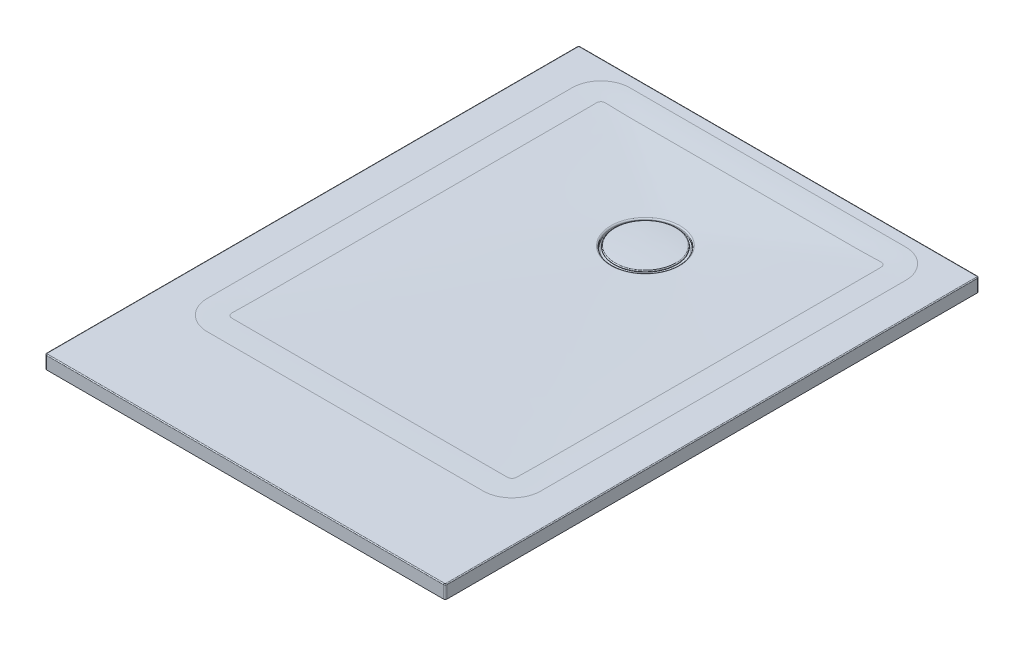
SolidWorks part; units mm, degrees
ref_plane "Płaszczyzna przednia" through (0, 0, 0) normal (0, 0, 1) x (1, 0, 0)
ref_plane "Płaszczyzna górna" through (0, 0, 0) normal (0, 1, 0) x (1, 0, 0)
ref_plane "Płaszczyzna prawa" through (0, 0, 0) normal (1, 0, 0) x (0, 0, -1)
sketch "Szkic2" plane through (0, 0, 0) normal (0, 1, 0) x (1, 0, 0)
  line L0 (0, 600) -> (0, 300) construction
  line L1 (-450, -600) -> (450, -600)
  line L2 (-450, -600) -> (-450, 600)
  line L3 (-450, 600) -> (450, 600)
  line L4 (450, -600) -> (450, 600)
  line L5 (-450, -600) -> (450, 600) construction
  line L6 (-450, 600) -> (450, -600) construction
  line L7 (-360, 560) -> (360, 560)
  line L8 (-360, 560) -> (-360, -360)
  line L9 (-360, -360) -> (360, -360)
  line L10 (360, 560) -> (360, -360)
  line L11 (-400, 600) -> (-400, -400) construction
  line L12 (-400, -400) -> (400, -400) construction
  line L13 (400, -400) -> (400, 600) construction
  circle A0 centre (0, 300) radius 75
  point P0 (0, 0)
  point P11 (0, 560)
  point P16 (0, -400)
  dimension "D9" = 150
  dimension "D1" = 900
  dimension "D2" = 1200
  dimension "D3" = 40
  dimension "D4" = 90
  dimension "D5" = 40
  dimension "D6" = 50
  dimension "D7" = 1000
  dimension "D8" = 300
  dimension "D10" = 800
sketch "Szkic3" plane through (0, 0, 0) normal (0, 1, 0) x (1, 0, 0)
  line L0 (-450, -600) -> (-450, 600) construction
  line L1 (-450, -600) -> (450, -600) construction
  line L2 (450, -600) -> (450, 600) construction
  line L3 (-450, 600) -> (450, 600) construction
  line L4 (-360, 560) -> (-360, -360) construction
  line L5 (-360, 560) -> (360, 560) construction
  line L6 (360, 560) -> (360, -360) construction
  line L7 (-360, -360) -> (360, -360) construction
  line L8 (-450, -600) -> (-450, 600)
  line L9 (-450, -600) -> (450, -600)
  line L10 (450, -600) -> (450, 600)
  line L11 (-450, 600) -> (450, 600)
  line L12 (-360, 510) -> (-360, -310)
  line L13 (-310, 560) -> (310, 560)
  line L14 (360, 510) -> (360, -310)
  line L15 (-310, -360) -> (310, -360)
  arc A0 (360, 510) -> (310, 560) centre (310, 510) ccw
  arc A1 (-310, 560) -> (-360, 510) centre (-310, 510) ccw
  arc A2 (310, -360) -> (360, -310) centre (310, -310) ccw
  arc A3 (-310, -360) -> (-360, -310) centre (-310, -310) cw
  dimension "D1" = 50
surface "Powierzchnia-Płaszczyzna1" sketch "Szkic3"
sketch "Szkic4" plane through (0, 0, 0) normal (0, 1, 0) x (1, 0, 0)
  line L0 (-360, 560) -> (-360, -360) construction
  line L1 (-360, -360) -> (360, -360) construction
  line L2 (360, 560) -> (360, -360) construction
  line L3 (-360, 560) -> (360, 560) construction
  line L4 (-360, 560) -> (-360, -360)
  line L5 (-360, -360) -> (360, -360)
  line L6 (360, 560) -> (360, -360)
  line L7 (-360, 560) -> (360, 560)
ref_plane "korek" through (0, -15, 0) normal (0, 1, 0) x (-1, 0, 0)
sketch "Szkic5" plane through (0, -15, 0) normal (0, 1, 0) x (-1, 0, 0)
  circle A0 centre (0, -300) radius 75 construction
  circle A1 centre (0, -300) radius 75
surface "Powierzchnia-Wyciągnięcie po profilach2"
surface "Powierzchnia-Połącz1"
sketch "Szkic7" plane through (0, 0, 0) normal (0, 1, 0) x (1, 0, 0)
  line L27 (310, 520) -> (-310, 520)
  line L28 (-320, 510) -> (-320, -310)
  line L29 (-310, -320) -> (310, -320)
  line L30 (320, -310) -> (320, 510)
  line L31 (310, 520) -> (-310, 520)
  line L32 (-320, 510) -> (-320, -310)
  line L33 (-310, -320) -> (310, -320)
  line L34 (320, -310) -> (320, 510)
  line L35 (310, 575) -> (-310, 575)
  line L36 (-375, 510) -> (-375, -310)
  line L37 (-310, -375) -> (310, -375)
  line L38 (375, -310) -> (375, 510)
  line L39 (310, 575) -> (-310, 575)
  line L40 (-375, 510) -> (-375, -310)
  line L41 (-310, -375) -> (310, -375)
  line L42 (375, -310) -> (375, 510)
  arc A0 (320, -310) -> (310, -320) centre (310, -310) cw
  arc A1 (-320, -310) -> (-310, -320) centre (-310, -310) ccw
  arc A2 (320, 510) -> (310, 520) centre (310, 510) ccw
  arc A3 (-320, 510) -> (-310, 520) centre (-310, 510) cw
  spline S23 degree 3 poles (-644.5147, 245.9802) (171.2043, 418.8752) (326.2977, 479.1809) (319.7452, 512.2677) (319.6663, 512.5844) (319.4754, 513.2122) (319.3641, 513.5243) (318.9882, 514.4323) (318.6812, 515.0063) (318.1376, 515.8212) (317.9416, 516.0859) (317.5238, 516.5955) (317.304, 516.838) (316.6127, 517.5298) (316.1098, 517.9439) (315.2907, 518.4921) (315.0069, 518.6625) (314.4301, 518.9711) (314.1356, 519.1106) (313.5345, 519.3602) (313.2279, 519.4703) (312.6025, 519.661) (312.2823, 519.7414) (192.0567, 543.8686) (-178.4054, -1686.1953) (51.6297, 1486.0367) knots -6.287354 -6.287354 -6.287354 -6.287354 0.125 0.125 0.1875 0.1875 0.25 0.25 0.375 0.375 0.4375 0.4375 0.5 0.5 0.625 0.625 0.6875 0.6875 0.75 0.75 0.8125 0.8125 0.875 0.875 24.080329 24.080329 24.080329 24.080329 only from (320, 510) to (310, 520)
  spline S24 degree 3 poles (-25.2636, -438.6041) (-190.5008, 290.0705) (-272.1359, 527.7513) (-312.2676, 519.7447) (-312.5843, 519.666) (-313.2122, 519.4757) (-313.5243, 519.3641) (-314.4322, 518.9881) (-315.0062, 518.6811) (-315.8213, 518.1376) (-316.086, 517.9416) (-316.5956, 517.5238) (-316.838, 517.304) (-317.5298, 516.6127) (-317.9438, 516.1098) (-318.4921, 515.2908) (-318.6622, 515.0069) (-318.9712, 514.4302) (-319.1106, 514.1357) (-319.3602, 513.5345) (-319.4701, 513.2278) (-319.6613, 512.6026) (-319.7419, 512.2823) (-327.5146, 473.272) (-107.0082, 409.1952) (654.3408, 284.9484) knots -7.667846 -7.667846 -7.667846 -7.667846 0.125 0.125 0.1875 0.1875 0.25 0.25 0.375 0.375 0.4375 0.4375 0.5 0.5 0.625 0.625 0.6875 0.6875 0.75 0.75 0.8125 0.8125 0.875 0.875 8.361168 8.361168 8.361168 8.361168 only from (-310, 520) to (-320, 510)
  spline S25 degree 3 poles (644.5148, -45.9802) (-171.2043, -218.8752) (-326.2977, -279.1809) (-319.7452, -312.2677) (-319.6663, -312.5844) (-319.4754, -313.2122) (-319.3641, -313.5243) (-318.9882, -314.4323) (-318.6812, -315.0063) (-318.1376, -315.8212) (-317.9416, -316.0859) (-317.5238, -316.5955) (-317.304, -316.838) (-316.6127, -317.5298) (-316.1098, -317.9439) (-315.2907, -318.4921) (-315.0069, -318.6625) (-314.4301, -318.9711) (-314.1356, -319.1106) (-313.5345, -319.3602) (-313.2279, -319.4703) (-312.6025, -319.661) (-312.2823, -319.7414) (-192.0567, -343.8686) (178.4054, 1886.1953) (-51.6297, -1286.0366) knots -6.287354 -6.287354 -6.287354 -6.287354 0.125 0.125 0.1875 0.1875 0.25 0.25 0.375 0.375 0.4375 0.4375 0.5 0.5 0.625 0.625 0.6875 0.6875 0.75 0.75 0.8125 0.8125 0.875 0.875 24.080329 24.080329 24.080329 24.080329 only from (-320, -310) to (-310, -320)
  spline S26 degree 3 poles (25.2636, 638.6045) (190.5008, -90.0705) (272.1359, -327.7513) (312.2676, -319.7447) (312.5843, -319.666) (313.2122, -319.4757) (313.5243, -319.3641) (314.4322, -318.9881) (315.0062, -318.6811) (315.8213, -318.1376) (316.086, -317.9416) (316.5956, -317.5238) (316.838, -317.304) (317.5298, -316.6127) (317.9438, -316.1098) (318.4921, -315.2908) (318.6622, -315.0069) (318.9712, -314.4302) (319.1106, -314.1357) (319.3602, -313.5345) (319.4701, -313.2278) (319.6613, -312.6026) (319.7419, -312.2823) (327.5146, -273.272) (107.0082, -209.1952) (-654.3408, -84.9484) knots -7.667846 -7.667846 -7.667846 -7.667846 0.125 0.125 0.1875 0.1875 0.25 0.25 0.375 0.375 0.4375 0.4375 0.5 0.5 0.625 0.625 0.6875 0.6875 0.75 0.75 0.8125 0.8125 0.875 0.875 8.361168 8.361168 8.361168 8.361168 only from (310, -320) to (320, -310)
  spline S31 degree 3 poles (-2411.2497, -561.1168) (-504.134, -35.3091) (394.2974, 318.7123) (374.4765, 518.4945) (374.1667, 520.5876) (373.3425, 524.739) (372.8287, 526.7974) (371.9013, 529.8583) (371.5655, 530.8759) (370.8439, 532.8945) (370.4596, 533.8908) (368.4228, 538.8084) (366.4283, 542.5401) (363.4836, 546.9545) (362.8718, 547.8248) (361.6019, 549.5396) (360.942, 550.3863) (358.9052, 552.8704) (357.4762, 554.4467) (352.9826, 558.9434) (349.7136, 561.6342) (345.2773, 564.6045) (344.3698, 565.1802) (342.5353, 566.2814) (341.6079, 566.8073) (338.7958, 568.3123) (336.8813, 569.2189) (332.9739, 570.8414) (330.9811, 571.5573) (327.9323, 572.4866) (326.9061, 572.7721) (324.8334, 573.2938) (323.785, 573.5303) (320.6361, 574.1599) (318.5251, 574.4738) (160.3036, 590.1164) (-57.9127, 46.5648) (-477.109, -2305.5721) knots -5.792026 -5.792026 -5.792026 -5.792026 0.0625 0.0625 0.125 0.125 0.1875 0.1875 0.21875 0.21875 0.25 0.25 0.375 0.375 0.40625 0.40625 0.4375 0.4375 0.5 0.5 0.625 0.625 0.65625 0.65625 0.6875 0.6875 0.75 0.75 0.8125 0.8125 0.84375 0.84375 0.875 0.875 0.9375 0.9375 5.533899 5.533899 5.533899 5.533899 only from (375, 510) to (310, 575)
  spline S32 degree 3 poles (602.1157, -2270.1847) (46.7654, 141.1642) (-174.116, 588.7103) (-318.4946, 574.4774) (-320.5876, 574.1671) (-324.7389, 573.342) (-326.7973, 572.8284) (-329.8583, 571.9014) (-330.8759, 571.5658) (-332.8944, 570.844) (-333.8907, 570.4597) (-338.8083, 568.4228) (-342.5401, 566.4283) (-346.9545, 563.4836) (-347.8247, 562.8718) (-349.5395, 561.6019) (-350.3863, 560.9421) (-352.8704, 558.9052) (-354.4467, 557.4762) (-358.9434, 552.9826) (-361.6341, 549.7136) (-364.6044, 545.2774) (-365.1802, 544.37) (-366.2813, 542.5354) (-366.8072, 541.608) (-368.3123, 538.7959) (-369.2189, 536.8814) (-370.8413, 532.974) (-371.5571, 530.981) (-372.4867, 527.9324) (-372.7723, 526.9062) (-373.294, 524.8335) (-373.5306, 523.7851) (-374.1595, 520.6361) (-374.4729, 518.525) (-416.7647, 93.4814) (3767.3883, -798.9712) (-1250.761, -669.055) knots -4.150679 -4.150679 -4.150679 -4.150679 0.0625 0.0625 0.125 0.125 0.1875 0.1875 0.21875 0.21875 0.25 0.25 0.375 0.375 0.40625 0.40625 0.4375 0.4375 0.5 0.5 0.625 0.625 0.65625 0.65625 0.6875 0.6875 0.75 0.75 0.8125 0.8125 0.84375 0.84375 0.875 0.875 0.9375 0.9375 13.39139 13.39139 13.39139 13.39139 only from (-310, 575) to (-375, 510)
  spline S33 degree 3 poles (2411.2502, 761.1169) (504.134, 235.3091) (-394.2974, -118.7123) (-374.4765, -318.4945) (-374.1667, -320.5876) (-373.3425, -324.739) (-372.8287, -326.7974) (-371.9013, -329.8583) (-371.5655, -330.8759) (-370.8439, -332.8945) (-370.4596, -333.8908) (-368.4228, -338.8084) (-366.4283, -342.5401) (-363.4836, -346.9545) (-362.8718, -347.8248) (-361.6019, -349.5396) (-360.942, -350.3863) (-358.9052, -352.8704) (-357.4762, -354.4467) (-352.9826, -358.9434) (-349.7136, -361.6342) (-345.2773, -364.6045) (-344.3698, -365.1802) (-342.5353, -366.2814) (-341.6079, -366.8073) (-338.7958, -368.3123) (-336.8813, -369.2189) (-332.9739, -370.8414) (-330.9811, -371.5573) (-327.9323, -372.4866) (-326.9061, -372.7721) (-324.8334, -373.2938) (-323.785, -373.5303) (-320.6361, -374.1599) (-318.5251, -374.4738) (-160.3036, -390.1164) (57.9127, 153.4352) (477.109, 2505.5721) knots -5.792026 -5.792026 -5.792026 -5.792026 0.0625 0.0625 0.125 0.125 0.1875 0.1875 0.21875 0.21875 0.25 0.25 0.375 0.375 0.40625 0.40625 0.4375 0.4375 0.5 0.5 0.625 0.625 0.65625 0.65625 0.6875 0.6875 0.75 0.75 0.8125 0.8125 0.84375 0.84375 0.875 0.875 0.9375 0.9375 5.533899 5.533899 5.533899 5.533899 only from (-375, -310) to (-310, -375)
  spline S34 degree 3 poles (-602.1157, 2470.1846) (-46.7654, 58.8358) (174.116, -388.7103) (318.4946, -374.4774) (320.5876, -374.1671) (324.7389, -373.342) (326.7973, -372.8284) (329.8583, -371.9014) (330.8759, -371.5658) (332.8944, -370.844) (333.8907, -370.4597) (338.8083, -368.4228) (342.5401, -366.4283) (346.9545, -363.4836) (347.8247, -362.8718) (349.5395, -361.6019) (350.3863, -360.9421) (352.8704, -358.9052) (354.4467, -357.4762) (358.9434, -352.9826) (361.6341, -349.7136) (364.6044, -345.2774) (365.1802, -344.37) (366.2813, -342.5354) (366.8072, -341.608) (368.3123, -338.7959) (369.2189, -336.8814) (370.8413, -332.974) (371.5571, -330.981) (372.4867, -327.9324) (372.7723, -326.9062) (373.294, -324.8335) (373.5306, -323.7851) (374.1595, -320.6361) (374.4729, -318.525) (416.7647, 106.5186) (-3767.3883, 998.9712) (1250.7611, 869.055) knots -4.150679 -4.150679 -4.150679 -4.150679 0.0625 0.0625 0.125 0.125 0.1875 0.1875 0.21875 0.21875 0.25 0.25 0.375 0.375 0.40625 0.40625 0.4375 0.4375 0.5 0.5 0.625 0.625 0.65625 0.65625 0.6875 0.6875 0.75 0.75 0.8125 0.8125 0.84375 0.84375 0.875 0.875 0.9375 0.9375 13.39139 13.39139 13.39139 13.39139 only from (310, -375) to (375, -310)
  spline S35 degree 3 poles (375, 510) (375, 512.1459) (374.8953, 514.274) (374.4765, 518.4945) (374.1667, 520.5876) (373.3425, 524.739) (372.8287, 526.7974) (371.9013, 529.8583) (371.5655, 530.8759) (370.8439, 532.8945) (370.4596, 533.8908) (368.4228, 538.8084) (366.4283, 542.5401) (363.4836, 546.9545) (362.8718, 547.8248) (361.6019, 549.5396) (360.942, 550.3863) (358.9052, 552.8704) (357.4762, 554.4467) (352.9826, 558.9434) (349.7136, 561.6342) (345.2773, 564.6045) (344.3698, 565.1802) (342.5353, 566.2814) (341.6079, 566.8073) (338.7958, 568.3123) (336.8813, 569.2189) (332.9739, 570.8414) (330.9811, 571.5573) (327.9323, 572.4866) (326.9061, 572.7721) (324.8334, 573.2938) (323.785, 573.5303) (320.6361, 574.1599) (318.5251, 574.4738) (314.2799, 574.8935) (312.1459, 575) (310, 575) knots 0 0 0 0 0.0625 0.0625 0.125 0.125 0.1875 0.1875 0.21875 0.21875 0.25 0.25 0.375 0.375 0.40625 0.40625 0.4375 0.4375 0.5 0.5 0.625 0.625 0.65625 0.65625 0.6875 0.6875 0.75 0.75 0.8125 0.8125 0.84375 0.84375 0.875 0.875 0.9375 0.9375 1 1 1 1
  spline S36 degree 3 poles (-310, 575) (-312.1459, 575) (-314.2737, 574.8935) (-318.4946, 574.4774) (-320.5876, 574.1671) (-324.7389, 573.342) (-326.7973, 572.8284) (-329.8583, 571.9014) (-330.8759, 571.5658) (-332.8944, 570.844) (-333.8907, 570.4597) (-338.8083, 568.4228) (-342.5401, 566.4283) (-346.9545, 563.4836) (-347.8247, 562.8718) (-349.5395, 561.6019) (-350.3863, 560.9421) (-352.8704, 558.9052) (-354.4467, 557.4762) (-358.9434, 552.9826) (-361.6341, 549.7136) (-364.6044, 545.2774) (-365.1802, 544.37) (-366.2813, 542.5354) (-366.8072, 541.608) (-368.3123, 538.7959) (-369.2189, 536.8814) (-370.8413, 532.974) (-371.5571, 530.981) (-372.4867, 527.9324) (-372.7723, 526.9062) (-373.294, 524.8335) (-373.5306, 523.7851) (-374.1595, 520.6361) (-374.4729, 518.525) (-374.8953, 514.2802) (-375, 512.1459) (-375, 510) knots 0 0 0 0 0.0625 0.0625 0.125 0.125 0.1875 0.1875 0.21875 0.21875 0.25 0.25 0.375 0.375 0.40625 0.40625 0.4375 0.4375 0.5 0.5 0.625 0.625 0.65625 0.65625 0.6875 0.6875 0.75 0.75 0.8125 0.8125 0.84375 0.84375 0.875 0.875 0.9375 0.9375 1 1 1 1
  spline S37 degree 3 poles (-375, -310) (-375, -312.1459) (-374.8953, -314.274) (-374.4765, -318.4945) (-374.1667, -320.5876) (-373.3425, -324.739) (-372.8287, -326.7974) (-371.9013, -329.8583) (-371.5655, -330.8759) (-370.8439, -332.8945) (-370.4596, -333.8908) (-368.4228, -338.8084) (-366.4283, -342.5401) (-363.4836, -346.9545) (-362.8718, -347.8248) (-361.6019, -349.5396) (-360.942, -350.3863) (-358.9052, -352.8704) (-357.4762, -354.4467) (-352.9826, -358.9434) (-349.7136, -361.6342) (-345.2773, -364.6045) (-344.3698, -365.1802) (-342.5353, -366.2814) (-341.6079, -366.8073) (-338.7958, -368.3123) (-336.8813, -369.2189) (-332.9739, -370.8414) (-330.9811, -371.5573) (-327.9323, -372.4866) (-326.9061, -372.7721) (-324.8334, -373.2938) (-323.785, -373.5303) (-320.6361, -374.1599) (-318.5251, -374.4738) (-314.2799, -374.8935) (-312.1459, -375) (-310, -375) knots 0 0 0 0 0.0625 0.0625 0.125 0.125 0.1875 0.1875 0.21875 0.21875 0.25 0.25 0.375 0.375 0.40625 0.40625 0.4375 0.4375 0.5 0.5 0.625 0.625 0.65625 0.65625 0.6875 0.6875 0.75 0.75 0.8125 0.8125 0.84375 0.84375 0.875 0.875 0.9375 0.9375 1 1 1 1
  spline S38 degree 3 poles (310, -375) (312.1459, -375) (314.2737, -374.8935) (318.4946, -374.4774) (320.5876, -374.1671) (324.7389, -373.342) (326.7973, -372.8284) (329.8583, -371.9014) (330.8759, -371.5658) (332.8944, -370.844) (333.8907, -370.4597) (338.8083, -368.4228) (342.5401, -366.4283) (346.9545, -363.4836) (347.8247, -362.8718) (349.5395, -361.6019) (350.3863, -360.9421) (352.8704, -358.9052) (354.4467, -357.4762) (358.9434, -352.9826) (361.6341, -349.7136) (364.6044, -345.2774) (365.1802, -344.37) (366.2813, -342.5354) (366.8072, -341.608) (368.3123, -338.7959) (369.2189, -336.8814) (370.8413, -332.974) (371.5571, -330.981) (372.4867, -327.9324) (372.7723, -326.9062) (373.294, -324.8335) (373.5306, -323.7851) (374.1595, -320.6361) (374.4729, -318.525) (374.8953, -314.2802) (375, -312.1459) (375, -310) knots 0 0 0 0 0.0625 0.0625 0.125 0.125 0.1875 0.1875 0.21875 0.21875 0.25 0.25 0.375 0.375 0.40625 0.40625 0.4375 0.4375 0.5 0.5 0.625 0.625 0.65625 0.65625 0.6875 0.6875 0.75 0.75 0.8125 0.8125 0.84375 0.84375 0.875 0.875 0.9375 0.9375 1 1 1 1
  dimension "D3" = 10
  dimension "D1" = 40
  dimension "D2" = 15
other "Usuń ścianę1"
other "Granica-Powierzchnia1"
surface "Powierzchnia-Połącz2"
sketch "Szkic9" plane through (0, 0, 0) normal (0, 1, 0) x (1, 0, 0)
  line L0 (-450, -600) -> (450, -600) construction
  line L1 (-450, -600) -> (-450, 600) construction
  line L2 (450, -600) -> (450, 600) construction
  line L3 (-450, 600) -> (450, 600) construction
  line L4 (-450, -600) -> (450, -600)
  line L5 (-450, -600) -> (-450, 600)
  line L6 (450, -600) -> (450, 600)
  line L7 (-450, 600) -> (450, 600)
surface "Powierzchnia-Wyciągnięcie1" sketch "Szkic9" parameters "D1"=30
sketch "Szkic8" plane through (0, 0, 0) normal (1, 0, 0) x (0, 0, -1)
  line L0 (300, 0) -> (300, -30) construction
  line L1 (224.9999, -15) -> (225.2968, -23.5)
  line L4 (225.2968, -23.5) -> (248, -24.0945)
  line L5 (225.2968, -23.5) -> (300, -23.5) construction
  line L6 (248, -24.0945) -> (248, -30) construction
  line L7 (300, -30) -> (225.2968, -30) construction
  line L8 (225.2968, -30) -> (225.2968, -23.5) construction
  line L9 (255, -28) -> (255, -30)
  line L10 (248, -24.0945) -> (255, -28)
  dimension "D1" = 30
  dimension "D2" = 8.5
  dimension "D3" = 2
  dimension "D4" = 1.5
  dimension "D5" = 52
  dimension "D6" = 45
  dimension "D7" = 2
surface "Powierzchnia-Obrót1" sketch "Szkic8" parameters "D1"=360
surface "Powierzchnia-Płaszczyzna2"
surface "Powierzchnia-Połącz3"
fillet "Zaokrąglenie4" radius 4 4 edges at (-450, -15, -600) (450, -15, -600) (-450, -15, 600) (450, -15, 600)
fillet "Zaokrąglenie5" radius 3 3 edges at (0, -24.0945, -352) (0, -23.5, -374.7032)
fillet "Zaokrąglenie6" radius 2 9 edges at (448.8284, 0, 598.8284) (0, 0, 600) (-448.8284, 0, 598.8284) (-450, 0, 0) (-448.8284, 0, -598.8284) (0, 0, -600) (448.8284, 0, -598.8284) (450, 0, 0) (0, -28, -345)
sketch "Szkic11" plane through (0, 0, 0) normal (1, 0, 0) x (0, 0, -1)
  line L0 (300, 0) -> (300, -30) construction
  line L1 (-596, -30) -> (596, -30) construction
  line L2 (300, -17) -> (300, -11.5)
  line L14 (370, -11.5) -> (370, -14.5) construction
  line L16 (370, -17) -> (300, -17)
  line L18 (370, -17) -> (370, -16.3377)
  line L19 (300, -11.5) -> (370, -11.5) construction
  arc A0 (370, -16.3377) -> (368.1666, -14.3446) centre (368, -16.3377) ccw
  arc A6 (368.1666, -14.3446) -> (300, -11.5) centre (300, -829.6667) ccw
  dimension "D2" = 2
  dimension "D8" = 2.5
  dimension "D9" = 17
  dimension "D10" = 5.5
  dimension "D11" = 70
revolve "Obrót1" add sketch "Szkic11" angle 360 about L0
